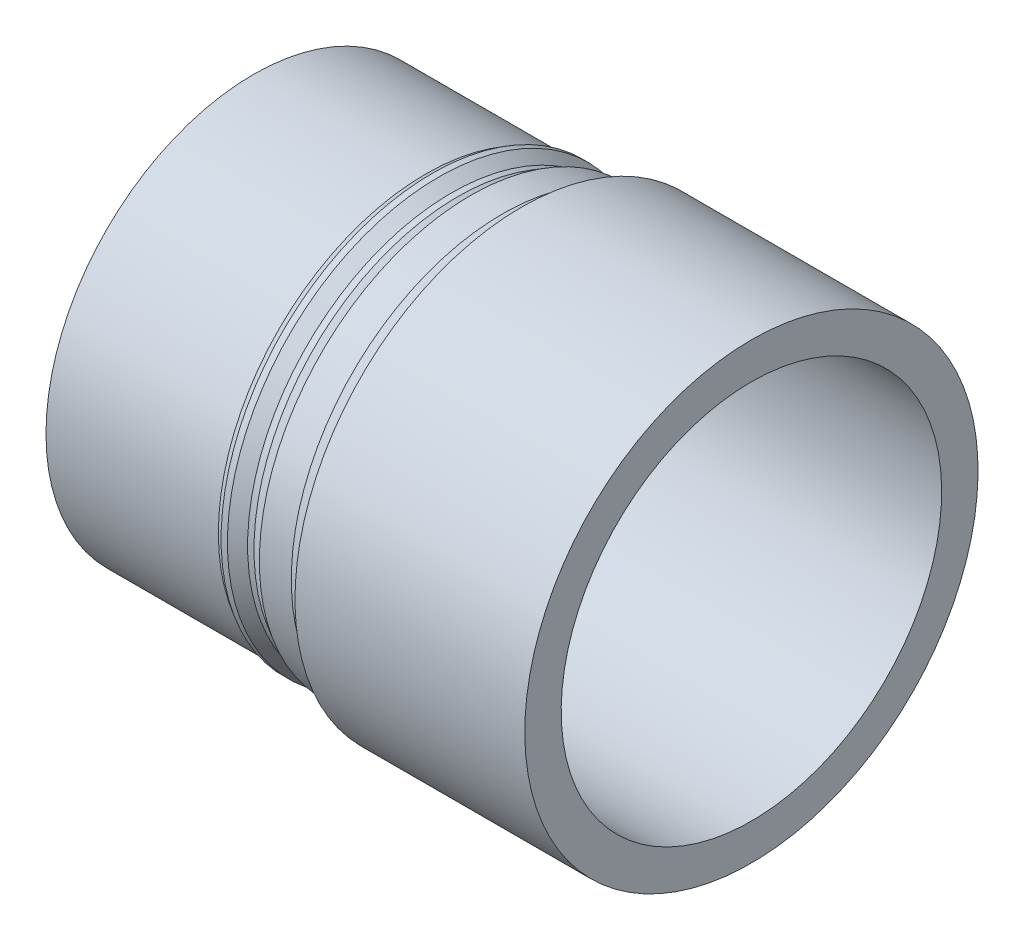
SolidWorks part; units mm, degrees
ref_plane "Alzado" through (0, 0, 0) normal (0, 0, 1) x (1, 0, 0)
ref_plane "Planta" through (0, 0, 0) normal (0, 1, 0) x (1, 0, 0)
ref_plane "Vista lateral" through (0, 0, 0) normal (1, 0, 0) x (0, 0, -1)
sketch "Croquis1" plane through (0, 0, 0) normal (0, 0, 1) x (1, 0, 0)
  line L0 (0, 0) -> (42, 0) construction
  line L1 (0, 0) -> (0, 32.5)
  line L2 (0, 32.5) -> (27, 32.5)
  line L3 (27, 32.5) -> (28, 33.0774)
  line L4 (28, 33.0774) -> (29, 33.0774)
  line L5 (28.5, 33.0774) -> (28.5, 0) construction
  line L6 (30, 32.5) -> (29, 33.0774)
  line L7 (30, 32.5) -> (31, 31.9226)
  line L8 (31, 31.9226) -> (32, 31.9226)
  line L9 (31.5, 31.9226) -> (31.5, 0) construction
  line L10 (33, 32.5) -> (32, 31.9226)
  line L11 (33, 32.5) -> (34, 33.0774)
  line L12 (34, 33.0774) -> (39, 33.0774)
  line L14 (42, 0) -> (0, 0)
  line L17 (42, 34.0774) -> (42, 0)
  line L18 (39, 33.0774) -> (42, 34.0774)
  dimension "D1" = 65
  dimension "D2" = 27
  dimension "D3" = 1
  dimension "D4" = 1
  dimension "D5" = 150
  dimension "D6" = 1
  dimension "D7" = 1
  dimension "D8" = 5
  dimension "D9" = 3
  dimension "D10" = 1
revolve "Revolución1" add sketch "Croquis1" angle 360 about L14
sketch "Croquis2" plane through (42, 0, 0) normal (1, 0, 0) x (0, 0, -1)
  circle A0 centre (0, 0) radius 35.5
  dimension "D1" = 71
extrude "Saliente-Extruir1" add sketch "Croquis2" along normal blind 36
sketch "Croquis3" plane through (78, 0, 0) normal (1, 0, 0) x (0, 0, -1)
  circle A0 centre (0, 0) radius 29.8
  dimension "D1" = 59.6
extrude "Cortar-Extruir1" cut sketch "Croquis3" against normal through all
